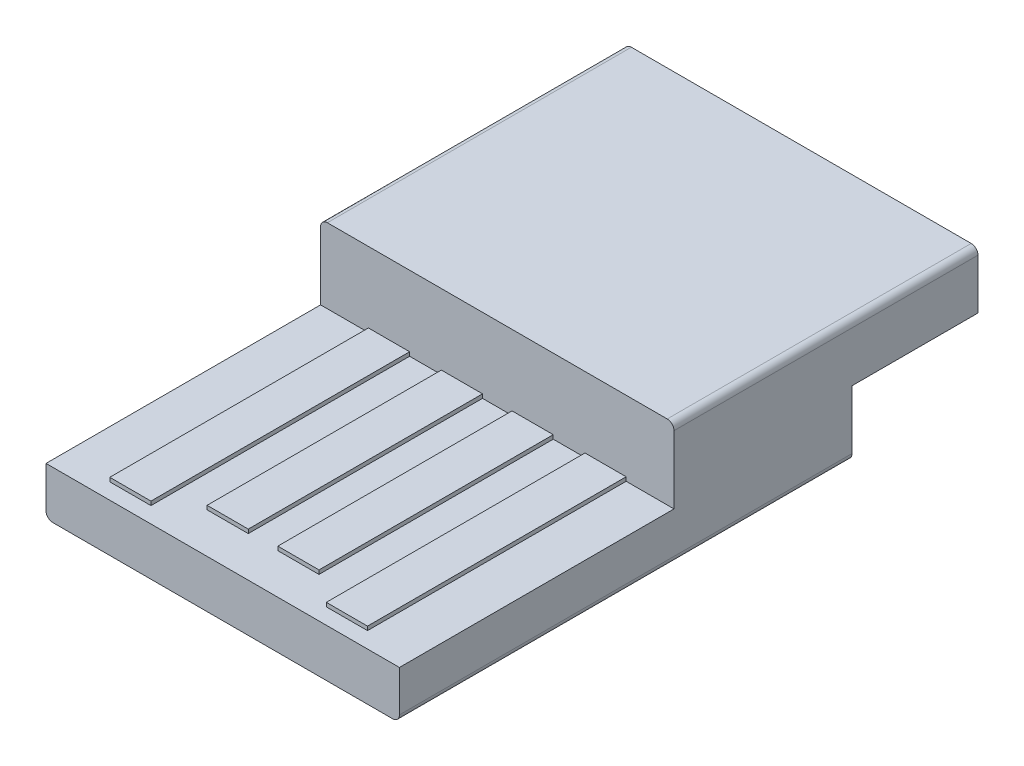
SolidWorks part; units mm, degrees
ref_plane "Front Plane" through (0, 0, 0) normal (0, 0, 1) x (1, 0, 0)
ref_plane "Top Plane" through (0, 0, 0) normal (0, 1, 0) x (1, 0, 0)
ref_plane "Right Plane" through (0, 0, 0) normal (1, 0, 0) x (0, 0, -1)
sketch "Sketch1" plane through (0, 0, 0) normal (0, 0, 1) x (1, 0, 0)
  line L1 (-5.7213, 1.7617) -> (-5.7213, -1.7617) construction
  line L3 (-5.5019, -1.9812) -> (-0.0063, -1.9812) construction
  line L5 (0.0064, -1.9812) -> (5.5019, -1.9812) construction
  line L6 (5.7214, -1.7617) -> (5.7214, 1.7617) construction
  line L7 (5.7214, -1.7617) -> (5.7214, -0.4318)
  line L9 (-5.7213, -0.4318) -> (5.7214, -0.4318)
  line L10 (0.0064, -1.9812) -> (5.5019, -1.9812)
  line L11 (-5.7213, -0.4318) -> (-5.7213, -1.7617)
  line L12 (-5.5019, -1.9812) -> (-0.0063, -1.9812)
  line L13 (-0.0063, -1.9812) -> (0.0064, -1.9812)
  arc A1 (-5.7213, -1.7617) -> (-5.5019, -1.9812) centre (-5.5019, -1.7617) ccw construction
  arc A3 (5.5019, -1.9812) -> (5.7214, -1.7617) centre (5.5019, -1.7617) ccw construction
  arc A4 (5.5019, -1.9812) -> (5.7214, -1.7617) centre (5.5019, -1.7617) ccw
  arc A5 (-5.7213, -1.7617) -> (-5.5019, -1.9812) centre (-5.5019, -1.7617) ccw
  dimension "D1" = 1.5494
extrude "Extrude1" add sketch "Sketch1" against normal blind 8.89
sketch "Sketch2" plane through (0, 0, -8.89) normal (0, 0, -1) x (-1, 0, 0)
  line L1 (-5.5019, 1.9812) -> (5.5019, 1.9812) construction
  line L2 (-5.5019, 1.9812) -> (5.5019, 1.9812)
  line L4 (5.7213, -1.7617) -> (5.7213, -0.4318)
  line L5 (5.7213, -0.4318) -> (-5.7214, -0.4318)
  line L6 (-5.7214, -0.4318) -> (-5.7214, -1.7617)
  line L7 (-5.5019, -1.9812) -> (5.5019, -1.9812)
  line L8 (5.7213, -1.7617) -> (5.7213, 1.7617)
  line L10 (-5.7214, 1.7617) -> (-5.7214, -1.7617)
  line L11 (-5.5019, -1.9812) -> (5.5019, -1.9812)
  arc A0 (5.7213, 1.7617) -> (5.5019, 1.9812) centre (5.5019, 1.7617) ccw construction
  arc A1 (-5.5019, 1.9812) -> (-5.7214, 1.7617) centre (-5.5019, 1.7617) ccw construction
  arc A2 (5.5019, -1.9812) -> (5.7213, -1.7617) centre (5.5019, -1.7617) ccw
  arc A3 (-5.7214, -1.7617) -> (-5.5019, -1.9812) centre (-5.5019, -1.7617) ccw
  arc A4 (5.5019, -1.9812) -> (5.7213, -1.7617) centre (5.5019, -1.7617) ccw
  arc A5 (-5.7214, -1.7617) -> (-5.5019, -1.9812) centre (-5.5019, -1.7617) ccw
  arc A6 (5.7213, 1.7617) -> (5.5019, 1.9812) centre (5.5019, 1.7617) ccw
  arc A7 (-5.5019, 1.9812) -> (-5.7214, 1.7617) centre (-5.5019, 1.7617) ccw
  dimension "D1" = 0
extrude "Extrude2" add sketch "Sketch2" along normal up to surface (5.7658 mm away)
sketch "Sketch3" plane through (0, 0, -14.6558) normal (0, 0, -1) x (-1, 0, 0)
  line L0 (-5.7214, 0.1397) -> (5.7213, 0.1397)
  line L1 (6.8707, 0.1397) -> (-6.8707, 0.1397) construction
  line L4 (-5.5019, -1.9812) -> (5.5019, -1.9812)
  line L5 (5.7213, -1.7617) -> (5.7213, 1.7617)
  line L6 (5.5019, 1.9812) -> (-5.5019, 1.9812)
  line L7 (-5.7214, 1.7617) -> (-5.7214, -1.7617)
  line L9 (5.7213, 0.1397) -> (5.7213, 1.7617)
  line L10 (5.5019, 1.9812) -> (-5.5019, 1.9812)
  line L11 (-5.7214, 1.7617) -> (-5.7214, 0.1397)
  arc A4 (5.5019, -1.9812) -> (5.7213, -1.7617) centre (5.5019, -1.7617) ccw
  arc A5 (5.7213, 1.7617) -> (5.5019, 1.9812) centre (5.5019, 1.7617) ccw
  arc A6 (-5.5019, 1.9812) -> (-5.7214, 1.7617) centre (-5.5019, 1.7617) ccw
  arc A7 (-5.7214, -1.7617) -> (-5.5019, -1.9812) centre (-5.5019, -1.7617) ccw
  arc A9 (5.7213, 1.7617) -> (5.5019, 1.9812) centre (5.5019, 1.7617) ccw
  arc A10 (-5.5019, 1.9812) -> (-5.7214, 1.7617) centre (-5.5019, 1.7617) ccw
  dimension "D1" = 0
extrude "Extrude3" add sketch "Sketch3" along normal up to surface (4.0767 mm away)
sketch "Sketch4" plane through (0, -0.4318, 0) normal (0, 1, 0) x (1, 0, 0)
  line L0 (5.7214, 8.89) -> (-5.7213, 8.89) construction
  line L1 (0.478, 1.3059) -> (1.8115, 1.3059)
  line L2 (0.478, 1.3059) -> (0.478, 8.89)
  line L3 (0.478, 8.89) -> (1.8115, 8.89)
  line L4 (1.8115, 1.3059) -> (1.8115, 8.89)
  line L5 (0, 0) -> (0, 3.5401) construction
  line L6 (2.8387, 0.5156) -> (4.1722, 0.5156)
  line L7 (2.8387, 0.5156) -> (2.8387, 8.89)
  line L8 (2.8387, 8.89) -> (4.1722, 8.89)
  line L9 (4.1722, 0.5156) -> (4.1722, 8.89)
  line L10 (5.7214, 0) -> (-5.7213, 0) construction
  line L11 (-4.1722, 0.5156) -> (-4.1722, 8.89)
  line L12 (-2.8387, 8.89) -> (-4.1722, 8.89)
  line L13 (-2.8387, 0.5156) -> (-2.8387, 8.89)
  line L14 (-2.8387, 0.5156) -> (-4.1722, 0.5156)
  line L15 (-1.8115, 1.3059) -> (-1.8115, 8.89)
  line L16 (-0.478, 8.89) -> (-1.8115, 8.89)
  line L17 (-0.478, 1.3059) -> (-0.478, 8.89)
  line L18 (-0.478, 1.3059) -> (-1.8115, 1.3059)
  dimension "D1" = 1.3335
extrude "Extrude4" add sketch "Sketch4" along normal blind 0.127
